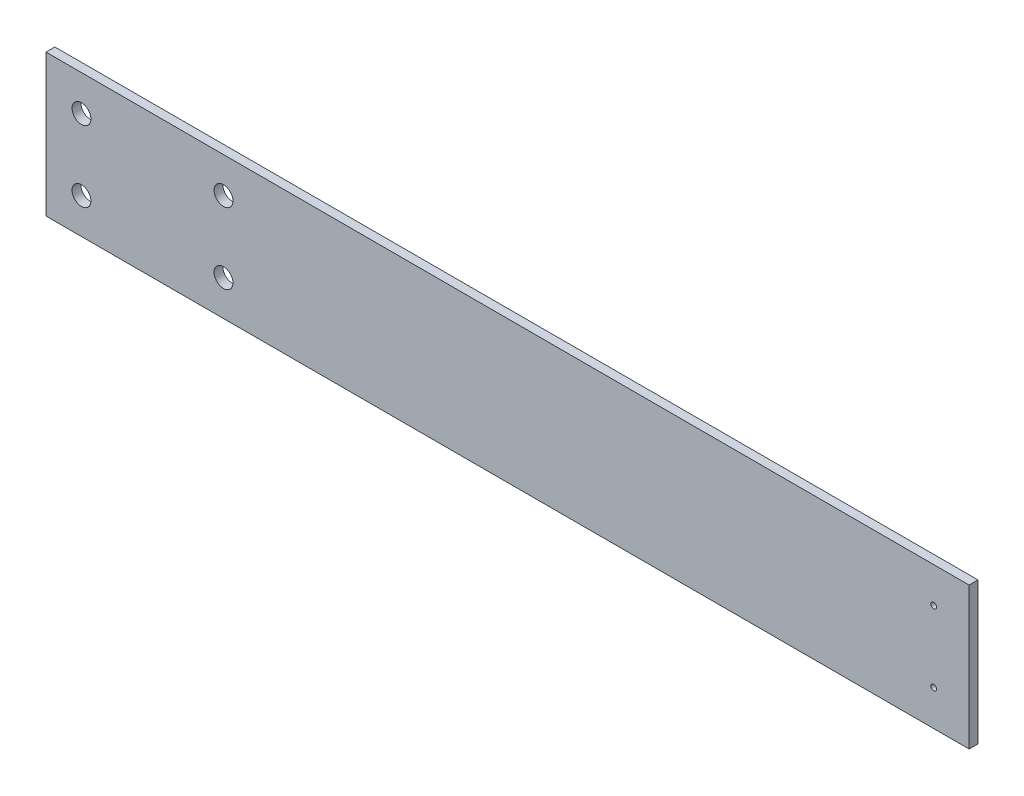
SolidWorks part; units mm, degrees
ref_plane "Front Plane" through (0, 0, 0) normal (0, 0, 1) x (1, 0, 0)
ref_plane "Top Plane" through (0, 0, 0) normal (0, 1, 0) x (1, 0, 0)
ref_plane "Right Plane" through (0, 0, 0) normal (1, 0, 0) x (0, 0, -1)
sketch "Sketch2" plane through (0, 0, 0) normal (0, 0, 1) x (1, 0, 0)
  line L1 (0, 0) -> (330.2, 0)
  line L2 (0, 0) -> (0, 50.8)
  line L3 (0, 50.8) -> (330.2, 50.8)
  line L4 (330.2, 0) -> (330.2, 50.8)
  dimension "D1" = 50.8
  dimension "D2" = 330.2
extrude "Boss-Extrude1" add sketch "Sketch2" along normal blind 3.175
sketch "Sketch3" plane through (0, 0, 3.175) normal (0, 0, 1) x (1, 0, 0)
  line L0 (12.7, 0) -> (12.7, 50.8) construction
  line L1 (0, 0) -> (330.2, 0) construction
  line L2 (330.2, 50.8) -> (0, 50.8) construction
  line L3 (0, 50.8) -> (0, 0) construction
  line L4 (0, 38.1) -> (63.5, 38.1) construction
  line L5 (0, 12.7) -> (63.5, 12.7) construction
  line L6 (63.5, 50.8) -> (63.5, 0) construction
  line L7 (317.5, 50.8) -> (317.5, 0) construction
  line L8 (317.5, 38.1) -> (330.2, 38.1) construction
  line L9 (330.2, 0) -> (330.2, 50.8) construction
  line L10 (317.5, 12.7) -> (330.2, 12.7) construction
  dimension "D1" = 12.7
  dimension "D2" = 25.4
  dimension "D3" = 12.7
  dimension "D4" = 50.8
  dimension "D5" = 12.7
hole_wizard "1/4 Clearance Hole1" positions "Sketch5" profile "Sketch6" hole size "1/4" standard "ANSI Inch"
sketch "Sketch5" plane through (0, 0, 3.175) normal (0, 0, 1) x (1, 0, 0)
  line L0 (12.7, 0) -> (12.7, 50.8) construction
  line L1 (0, 38.1) -> (63.5, 38.1) construction
  line L2 (0, 12.7) -> (63.5, 12.7) construction
  point P0 (12.7, 38.1)
  point P6 (12.7, 12.7)
  point P10 (63.5, 12.7)
  point P13 (63.5, 38.1)
sketch "Sketch6" plane through (12.7, 38.1, 3.175) normal (1, 0, 0) x (0, -1, 0)
  line L0 (0, 0) -> (0, 3.175)
  line L1 (0, 3.175) -> (3.3782, 3.175)
  line L2 (3.3782, 3.175) -> (3.3782, 0)
  line L5 (3.3782, 0) -> (0, 0)
  line L11 (0, -6.35) -> (0, 107.95) construction
  dimension "Thru Hole Dia." = 6.7564
  dimension "Thru Hole Depth" = 3.175
hole_wizard "#1 Clearance Hole1" positions "Sketch8" profile "Sketch7" hole size "#1" standard "ANSI Inch"
sketch "Sketch8" plane through (0, 0, 3.175) normal (0, 0, 1) x (1, 0, 0)
  point P0 (317.5, 38.1)
  point P3 (317.5, 12.7)
sketch "Sketch7" plane through (317.5, 38.1, 3.175) normal (1, 0, 0) x (0, -1, 0)
  line L0 (0, 0) -> (0, 3.175)
  line L1 (0, 3.175) -> (1.0287, 3.175)
  line L2 (1.0287, 3.175) -> (1.0287, 0)
  line L5 (1.0287, 0) -> (0, 0)
  line L11 (0, -6.35) -> (0, 107.95) construction
  dimension "Thru Hole Dia." = 2.0574
  dimension "Thru Hole Depth" = 3.175
